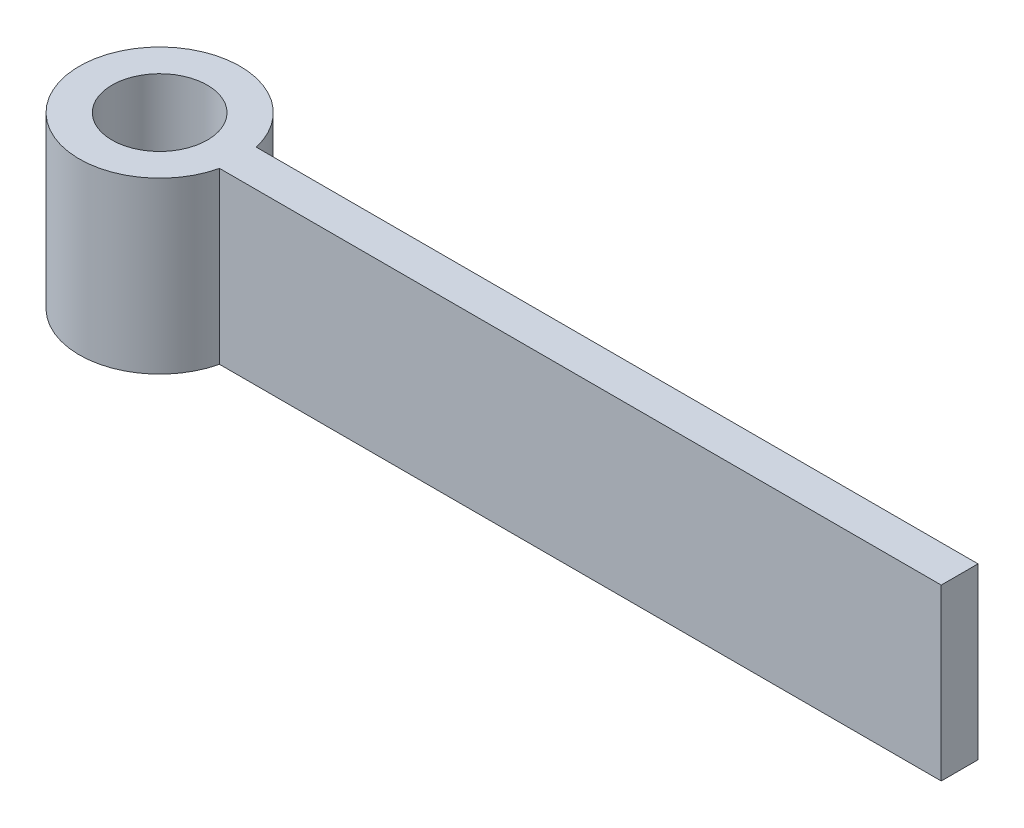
SolidWorks part; units mm, degrees
ref_plane "Front Plane" through (0, 0, 0) normal (0, 0, 1) x (1, 0, 0)
ref_plane "Top Plane" through (0, 0, 0) normal (0, 1, 0) x (1, 0, 0)
ref_plane "Right Plane" through (0, 0, 0) normal (1, 0, 0) x (0, 0, -1)
sketch "Sketch1" plane through (0, 0, 0) normal (0, 1, 0) x (1, 0, 0)
  circle A0 centre (0, 0) radius 30.9557
  circle A1 centre (0, 0) radius 52.2116
extrude "Extrude1" add sketch "Sketch1" along normal blind 110.236
sketch "Sketch2" plane through (0, 0, 0) normal (0, 0, 1) x (1, 0, 0)
  line L1 (30.9557, 110.236) -> (519.6029, 110.236)
  line L2 (30.9557, 110.236) -> (30.9557, 0)
  line L3 (30.9557, 0) -> (519.6029, 0)
  line L4 (519.6029, 110.236) -> (519.6029, 0)
extrude "Extrude2" add sketch "Sketch2" along normal mid plane 23.876
